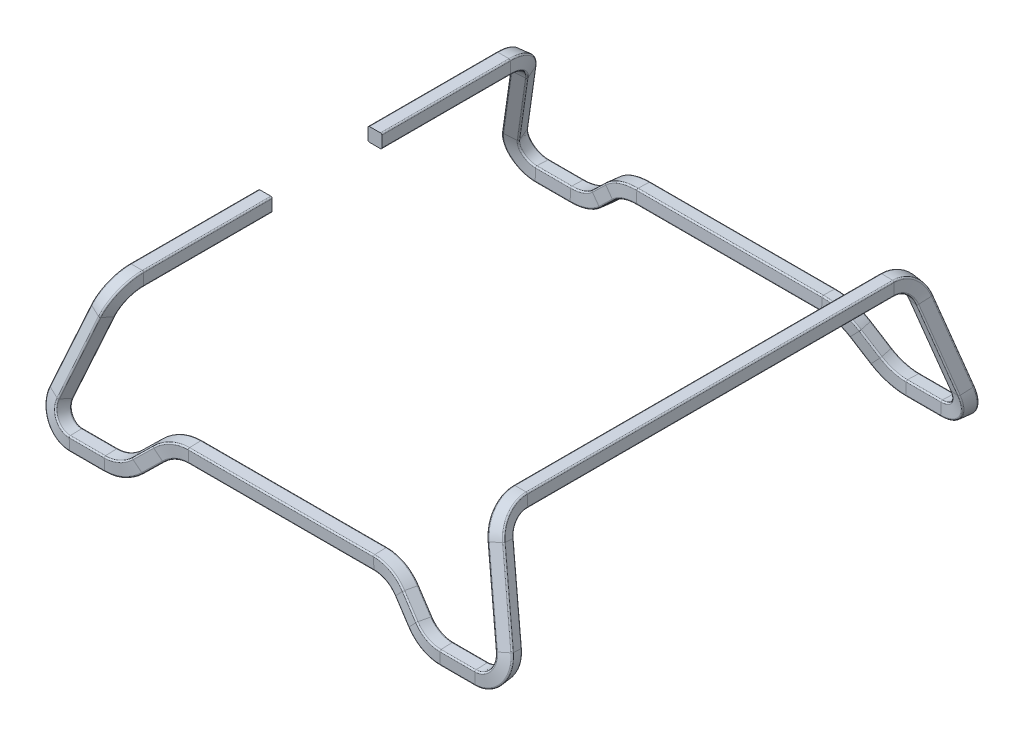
SolidWorks part; units mm, degrees
ref_plane "Front" through (0, 0, 0) normal (0, 0, 1) x (1, 0, 0)
ref_plane "Top" through (0, 0, 0) normal (0, 1, 0) x (1, 0, 0)
ref_plane "Right" through (0, 0, 0) normal (1, 0, 0) x (0, 0, -1)
sketch "Sketch2" plane through (0, 0, 0) normal (0, 1, 0) x (1, 0, 0)
  line L1 (85, -85) -> (-85, -85) construction
  line L2 (85, -85) -> (85, 85) construction
  line L3 (85, 85) -> (-85, 85) construction
  line L4 (-85, -85) -> (-85, 85) construction
  line L5 (85, -85) -> (-85, 85) construction
  line L6 (85, 85) -> (-85, -85) construction
  point P0 (0, 0)
  dimension "D1" = 170
  dimension "D2" = 170
ref_plane "Plane1" through (0, 45, 0) normal (0, 1, 0) x (1, 0, 0)
sketch "Sketch3" plane through (0, 45, 0) normal (0, 1, 0) x (1, 0, 0)
  line L1 (70, -75) -> (-70, -75) construction
  line L2 (70, -75) -> (70, 75) construction
  line L3 (70, 75) -> (-70, 75) construction
  line L4 (-70, -75) -> (-70, 75) construction
  line L5 (70, -75) -> (-70, 75) construction
  line L6 (70, 75) -> (-70, -75) construction
  point P0 (0, 0)
  dimension "D1" = 140
  dimension "D2" = 150
sketch3d "3DSketch1"
  line L0 (-70, 45, 75) -> (-70, 45, -75) construction
  line L1 (-70, 45, 66.8884) -> (-70, 45, 20)
  line L2 (-70, 45, 0) -> (0, 45, 0) construction
  line L3 (85, 0, 85) -> (-85, 0, 85) construction
  line L4 (-72.5099, 37.4702, 76.6733) -> (-81.5913, 10.226, 82.7276)
  line L6 (73.984, 0, 85) -> (61.2132, 0, 85)
  line L9 (70, 45, 75) -> (70, 45, -75) construction
  line L10 (70, 45, 66.8884) -> (70, 45, 0)
  line L11 (72.5099, 37.4702, 76.6733) -> (81.5913, 10.226, 82.7276)
  line L13 (0, 45, 75) -> (0, 14.6428, 81.746) construction
  line L14 (70, 45, 75) -> (-70, 45, 75) construction
  line L15 (0, 14.6428, 81.746) -> (0, 0, 85) construction
  line L16 (-33.7868, 14.6428, 81.746) -> (33.7868, 14.6428, 81.746)
  line L17 (-44.3934, 10.354, 82.6991) -> (-50.6066, 4.2888, 84.0469)
  line L18 (44.3934, 10.354, 82.6991) -> (50.6066, 4.2888, 84.0469)
  line L19 (-61.2132, 0, 85) -> (-73.984, 0, 85)
  arc A0 (73.984, 0, 85) -> (81.5913, 10.226, 82.7276) centre (73.984, 7.8095, 83.2646) ccw
  arc A1 (-73.984, 0, 85) -> (-81.5913, 10.226, 82.7276) centre (-73.984, 7.8095, 83.2646) ccw
  arc A2 (50.6066, 4.2888, 84.0469) -> (61.2132, 0, 85) centre (61.2132, 14.6428, 81.746) ccw
  arc A3 (-50.6066, 4.2888, 84.0469) -> (-61.2132, 0, 85) centre (-61.2132, 14.6428, 81.746) ccw
  arc A4 (33.7868, 14.6428, 81.746) -> (44.3934, 10.354, 82.6991) centre (33.7868, 0, 85) ccw
  arc A5 (-33.7868, 14.6428, 81.746) -> (-44.3934, 10.354, 82.6991) centre (-33.7868, 0, 85) ccw
  arc A6 (70, 45, 66.8884) -> (72.5099, 37.4702, 76.6733) centre (73.1623, 35.5132, 66.8884) ccw
  arc A7 (-70, 45, 66.8884) -> (-72.5099, 37.4702, 76.6733) centre (-73.1623, 35.5132, 66.8884) ccw
  point P19 (85, 0, 85)
  point P21 (73.984, 9.5449, 91.0741)
  point P27 (-85, 0, 85)
  point P29 (-73.984, 6.0741, 75.4551)
  point P32 (55, 0, 85)
  point P33 (61.2132, 17.8968, 96.3888)
  point P36 (-55, 0, 85)
  point P37 (-61.2132, 11.3888, 67.1032)
  point P40 (40, 14.6428, 81.746)
  point P41 (33.7868, -3.254, 70.3572)
  point P44 (-40, 14.6428, 81.746)
  point P45 (-33.7868, 3.254, 99.6428)
  point P48 (70, 45, 75)
  point P50 (82.6491, 38.6754, 66.8884)
  point P53 (-70, 45, 75)
  point P55 (-63.6754, 32.3509, 66.8884)
  dimension "D6" = 8
  dimension "D7" = 15
  dimension "D8" = 15
  dimension "D9" = 10
  dimension "D1" = 30
  dimension "D2" = 15
  dimension "D3" = 80
  dimension "D4" = 40
  dimension "D5" = 30
sketch "Sketch5" plane through (0, 0, 0) normal (0, 0, 1) x (1, 0, 0)
  line L1 (72, 42.5) -> (68, 42.5)
  line L2 (72.5, 43) -> (72.5, 47)
  line L3 (72, 47.5) -> (68, 47.5)
  line L4 (67.5, 43) -> (67.5, 47)
  line L5 (72.5, 42.5) -> (67.5, 47.5) construction
  line L6 (72.5, 47.5) -> (67.5, 42.5) construction
  circle A0 centre (70, 45) radius 1.5 construction
  arc A1 (72, 42.5) -> (72.5, 43) centre (72, 43) ccw
  arc A2 (68, 42.5) -> (67.5, 43) centre (68, 43) cw
  arc A3 (68, 47.5) -> (67.5, 47) centre (68, 47) ccw
  arc A4 (72.5, 47) -> (72, 47.5) centre (72, 47) ccw
  dimension "D1" = 3
  dimension "D3" = 0.5
  dimension "D2" = 5
sweep "Sweep1" add profiles "Sketch5" path "3DSketch1"
mirror "Mirror1" about plane through (0, 0, 0) normal (0, 0, 1) of "Sweep1"
